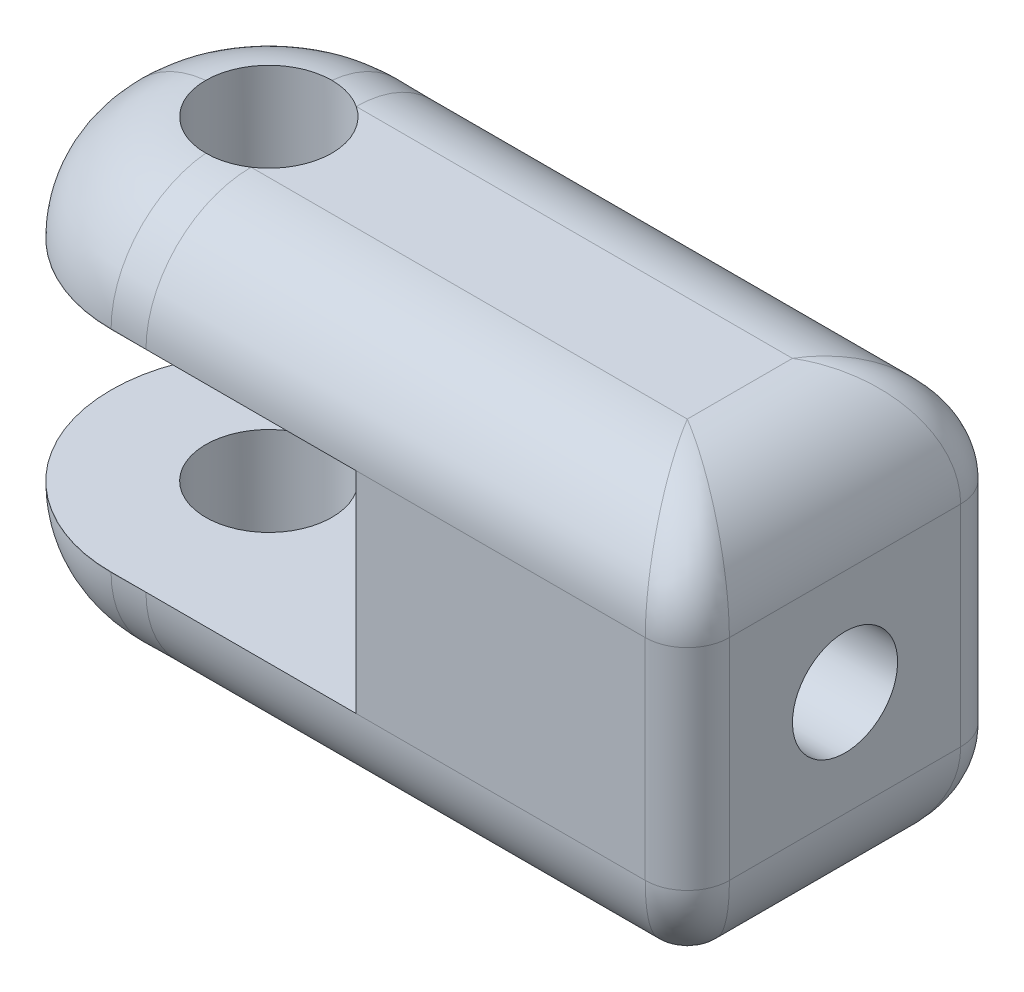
SolidWorks part; units mm, degrees
ref_plane "Face" through (0, 0, 0) normal (0, 0, 1) x (1, 0, 0)
ref_plane "Dessus" through (0, 0, 0) normal (0, 1, 0) x (1, 0, 0)
ref_plane "Droite" through (0, 0, 0) normal (1, 0, 0) x (0, 0, -1)
sketch "Esquisse1" plane through (0, 0, 0) normal (0, 0, 1) x (1, 0, 0)
  line L0 (-36.1162, -18.7626) -> (-36.1162, -28.7626)
  line L1 (-36.1162, 11.2374) -> (33.6842, 11.2374)
  line L2 (-36.1162, 11.2374) -> (-36.1162, 1.2374)
  line L3 (-36.1162, -28.7626) -> (33.6842, -28.7626)
  line L4 (33.6842, 11.2374) -> (33.6842, -28.7626)
  line L5 (-36.1162, 1.2374) -> (2.1537, 1.2374)
  line L7 (-36.1162, -18.7626) -> (2.1537, -18.7626)
  line L8 (2.1537, 1.2374) -> (2.1537, -18.7626)
  dimension "D1" = 40
  dimension "D2" = 10
  dimension "D3" = 20
extrude "Boss.-Extru.1" add sketch "Esquisse1" along normal blind 30
fillet "Congé1" radius 15 4 edges at (-36.1162, -23.7626, 30) (-36.1162, -23.7626, 0) (-36.1162, 6.2374, 0) (-36.1162, 6.2374, 30)
fillet "Congé5" radius 10 2 edges at (33.6842, 11.2374, 15) (33.6842, -28.7626, 15)
sketch "Esquisse2" plane through (0, -28.7626, 0) normal (0, -1, 0) x (1, 0, 0)
  circle A0 centre (-21.1162, 15) radius 6
  dimension "D1" = 12
extrude "Enlèv. mat.-Extru.1" cut sketch "Esquisse2" against normal through all
sketch "Esquisse3" plane through (33.6842, 0, 0) normal (1, 0, 0) x (0, 0, -1)
  circle A0 centre (-15, -8.7626) radius 5
  dimension "D1" = 10
extrude "Enlèv. mat.-Extru.2" cut sketch "Esquisse3" against normal through all
fillet "Congé6" radius 10 4 edges at (1.284, -28.7626, 0) (1.284, 11.2374, 0) (1.284, 11.2374, 30) (1.284, -28.7626, 30)
fillet "Congé7" radius 4 6 edges at (30.7553, -25.8337, 2.9289) (30.7553, 8.3085, 2.9289) (30.7553, -25.8337, 27.0711) (30.7553, 8.3085, 27.0711) (33.6842, -8.7626, 0) (33.6842, -8.7626, 30)
